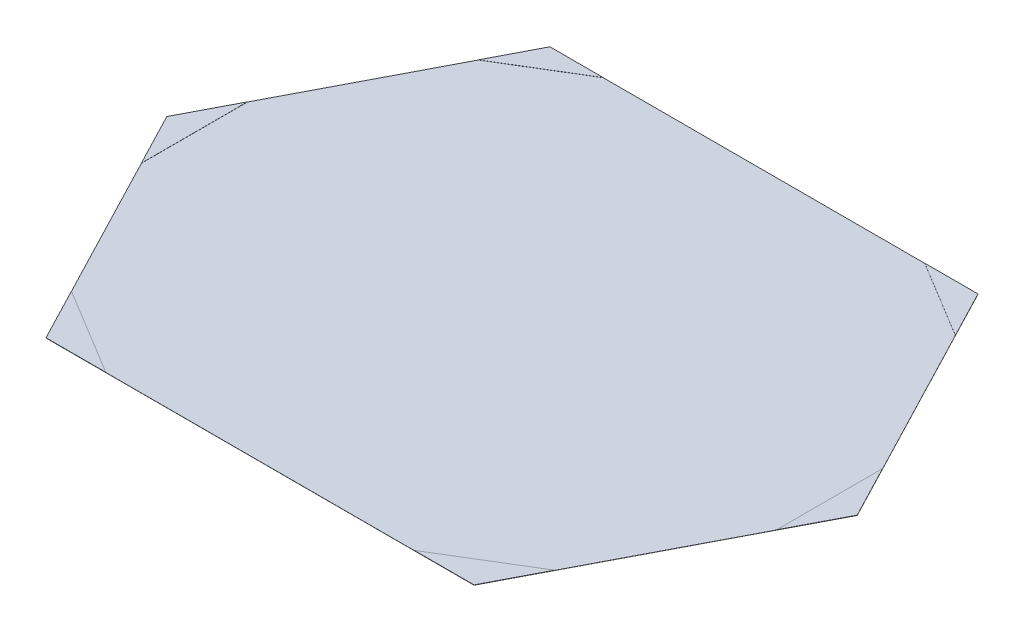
SolidWorks part; units mm, degrees
ref_plane "Plan de face" through (0, 0, 0) normal (0, 0, 1) x (1, 0, 0)
ref_plane "Plan de dessus" through (0, 0, 0) normal (0, 1, 0) x (1, 0, 0)
ref_plane "Plan de droite" through (0, 0, 0) normal (1, 0, 0) x (0, 0, -1)
sketch "Esquisse1" plane through (0, 0, 0) normal (0, 1, 0) x (1, 0, 0)
  line L0 (0, 0) -> (5000, 0) construction
  line L1 (0, 0) -> (950, 1825)
  line L2 (950, 1825) -> (4050, 1825)
  line L3 (4050, 1825) -> (5000, 0)
  line L4 (4050, -1825) -> (5000, 0)
  line L5 (950, -1825) -> (4050, -1825)
  line L6 (0, 0) -> (950, -1825)
  dimension "D1" = 950
  dimension "D2" = 1825
  dimension "D3" = 950
  dimension "D4" = 3100
extrude "Boss.-Extru.1" add sketch "Esquisse1" along normal blind 1
sketch "Esquisse2" plane through (0, 1, 0) normal (0, 1, 0) x (1, 0, 0)
  line L0 (771.9918, 1483.0368) -> (1335.5201, 1825)
  line L1 (950, 1825) -> (0, 0) construction
  line L2 (4050, 1825) -> (950, 1825) construction
  line L3 (1335.5201, 1825) -> (950, 1825)
  line L4 (950, 1825) -> (771.9918, 1483.0368)
  line L6 (3664.4799, 1825) -> (4050, 1825)
  line L7 (4050, 1825) -> (4228.0082, 1483.0368)
  line L8 (5000, 0) -> (4050, 1825) construction
  line L9 (4228.0082, 1483.0368) -> (3664.4799, 1825)
  line L10 (3664.4799, 1825) -> (3669.0395, 1817.4861)
  line L11 (4800, 384.2105) -> (5000, 0)
  line L12 (5000, 0) -> (4800, -384.2105)
  line L13 (4050, -1825) -> (5000, 0) construction
  line L14 (4800, -384.2105) -> (4800, 384.2105)
  line L15 (4050, -1825) -> (4250, -1440.7895)
  line L16 (4250, -1440.7895) -> (3616.8514, -1825)
  line L17 (950, -1825) -> (4050, -1825) construction
  line L18 (3616.8514, -1825) -> (4050, -1825)
  line L19 (750, -1440.7895) -> (1383.1486, -1825)
  line L20 (0, 0) -> (950, -1825) construction
  line L21 (1383.1486, -1825) -> (950, -1825)
  line L22 (950, -1825) -> (750, -1440.7895)
  line L23 (0, 0) -> (200, 384.2105)
  line L24 (200, 384.2105) -> (200, -384.2105)
  line L25 (200, -384.2105) -> (0, 0)
  dimension "D1" = 200
  dimension "D2" = 200
extrude "Boss.-Extru.2" add sketch "Esquisse2" along normal blind 1 contours L24 M6 M1 | L16 M3 M2 | L19 M1 M2 | L0 L3 L4 | L6 L7 L9 | L11 L12 L14
